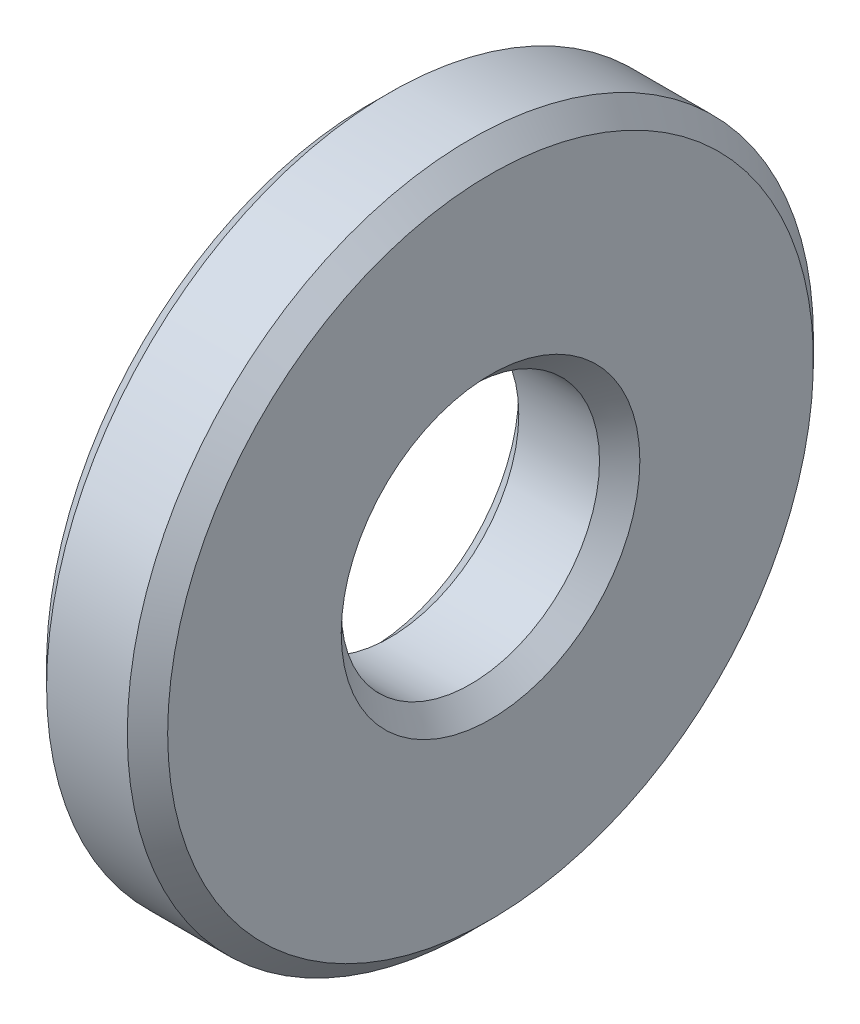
SolidWorks part; units mm, degrees
ref_plane "Plan1" through (0, 0, 0) normal (0, 0, 1) x (1, 0, 0)
ref_plane "Plan2" through (0, 0, 0) normal (0, 1, 0) x (1, 0, 0)
ref_plane "Plan3" through (0, 0, 0) normal (1, 0, 0) x (0, 0, -1)
sketch "Esquisse1" plane through (0, 0, 0) normal (0, 0, 1) x (1, 0, 0)
  line L0 (0, 0) -> (20, 0) construction
  line L2 (0, 3.2) -> (3, 3.2)
  line L3 (0, 3.2) -> (0, 8.5)
  line L4 (0, 8.5) -> (3, 8.5)
  line L5 (3, 3.2) -> (3, 8.5)
  dimension "D1" = 3
  dimension "D2" = 3.2
  dimension "D3" = 8.5
revolve "Base-Révolution" add sketch "Esquisse1" angle 360 about L0
chamfer "Chanfrein1" distance 0.5 angle 45 4 edges at (0, 0, 3.2) (3, 0, 3.2) (3, 0, 8.5) (0, 0, 8.5)
sketch "Esq_WRNL_Compact001" plane through (0, 0, 0) normal (0, 0, 1) x (1, 0, 0)
  line L0 (-1, -9.5) -> (-1, 9.5)
  line L1 (4, -9.5) -> (4, 9.5)
  line L2 (-1, -9.5) -> (4, -9.5)
  line L3 (-1, 9.5) -> (4, 9.5)
